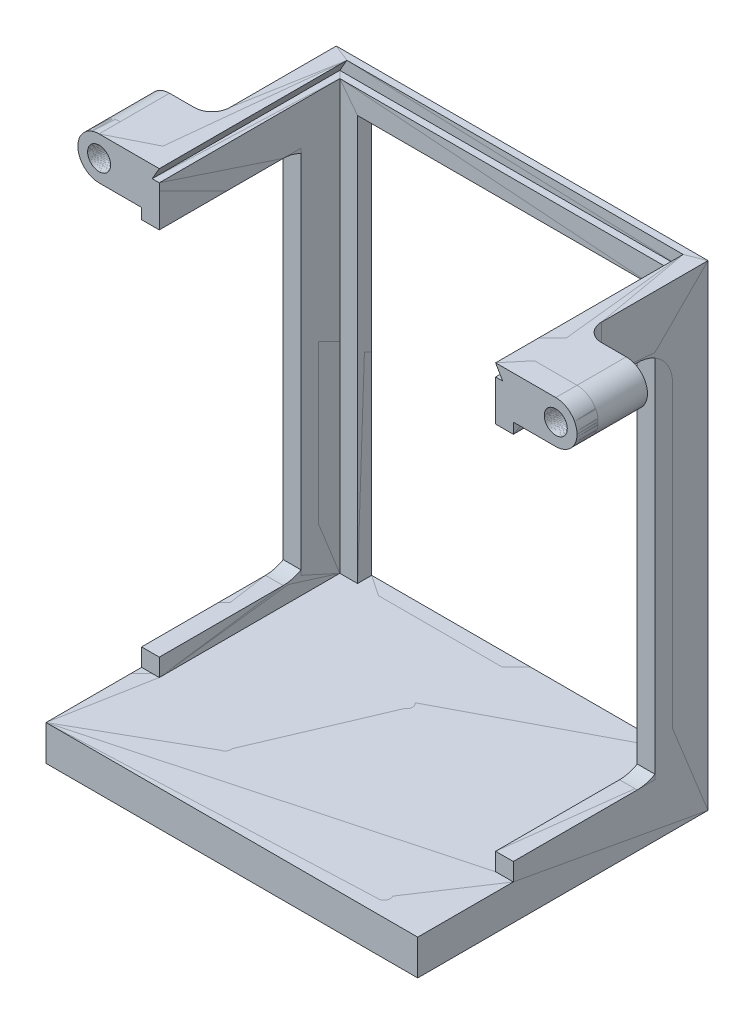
SolidWorks part; units mm, degrees
ref_plane "Front Plane" through (0, 0, 0) normal (0, 0, 1) x (1, 0, 0)
ref_plane "Top Plane" through (0, 0, 0) normal (0, 1, 0) x (1, 0, 0)
ref_plane "Right Plane" through (0, 0, 0) normal (1, 0, 0) x (0, 0, -1)
imported_body "Back Plate.STEP<1>"
sketch "Sketch1" plane through (0, 0, 8) normal (0, 0, -1) x (-1, 0, 0)
  line L0 (-64.5, 122.5) -> (-52.5, 122.5)
  line L1 (-52.5, 122.5) -> (-52.5, 134.5)
  line L2 (-52.5, 134.5) -> (-64.5, 134.5)
  line L3 (64.5, 134.5) -> (52.5, 134.5)
  line L4 (52.5, 134.5) -> (52.5, 122.5)
  line L5 (52.5, 122.5) -> (64.5, 122.5)
  circle A0 centre (-64.5, 128.5) radius 3.25
  circle A1 centre (64.5, 128.5) radius 3.25
  arc A2 (-64.5, 122.5) -> (-64.5, 134.5) centre (-64.5, 128.5) cw
  arc A3 (64.5, 134.5) -> (64.5, 122.5) centre (64.5, 128.5) cw
  arc A4 (64.5, 122.5) -> (64.5, 134.5) centre (64.5, 128.5) ccw construction
  arc A5 (61.25, 128.5) -> (67.75, 128.5) centre (64.5, 128.5) ccw construction
extrude "Boss-Extrude1" add sketch "Sketch1" along normal blind 13.9
sketch "Sketch3" plane through (52.5, 0, 0) normal (1, 0, 0) x (0, 0, -1)
  line L1 (26, 15) -> (31, 15)
  line L2 (26, 15) -> (26, 119.5)
  line L3 (26, 119.5) -> (31, 119.5)
  line L4 (31, 15) -> (31, 119.5)
  dimension "D1" = 5
extrude "Cut-Extrude1" cut sketch "Sketch3" against normal blind 199.9
fillet "Fillet1" radius 10 4 edges at (50, 15, -31) (50, 119.5, -31) (-50, 119.5, -31) (-50, 15, -31)
fillet "Fillet2" radius 5 2 edges at (-52.5, 128.5, -5.9) (52.5, 128.5, -5.9)
sketch "Sketch4" plane through (0, 0, 0) normal (0, -1, 0) x (1, 0, 0)
  line L1 (-48.361, -21.674) -> (37.3028, -21.674)
  line L2 (-48.361, -21.674) -> (-48.361, 35.5335)
  line L3 (-48.361, 35.5335) -> (37.3028, 35.5335)
  line L4 (37.3028, -21.674) -> (37.3028, 35.5335)
extrude "Boss-Extrude2" add sketch "Sketch4" against normal up to surface (10 mm away)
extrude "Cut-Extrude2" cut sketch "Sketch5" against normal blind 20
sketch "Sketch5" plane through (86.135, 0, -224.2425) normal (0, -1, 0) x (0, 0, 1)
  circle A0 centre (245.7125, 107.6398) radius 1.75
  circle A1 centre (209.7125, 92.3602) radius 1.75
  circle A2 centre (259.7125, 48.6525) radius 1.75
  circle A3 centre (-245.7125, 107.6398) radius 1.75
  circle A4 centre (-209.7125, 92.3602) radius 1.75
  circle A5 centre (-259.7125, 48.6525) radius 1.75
